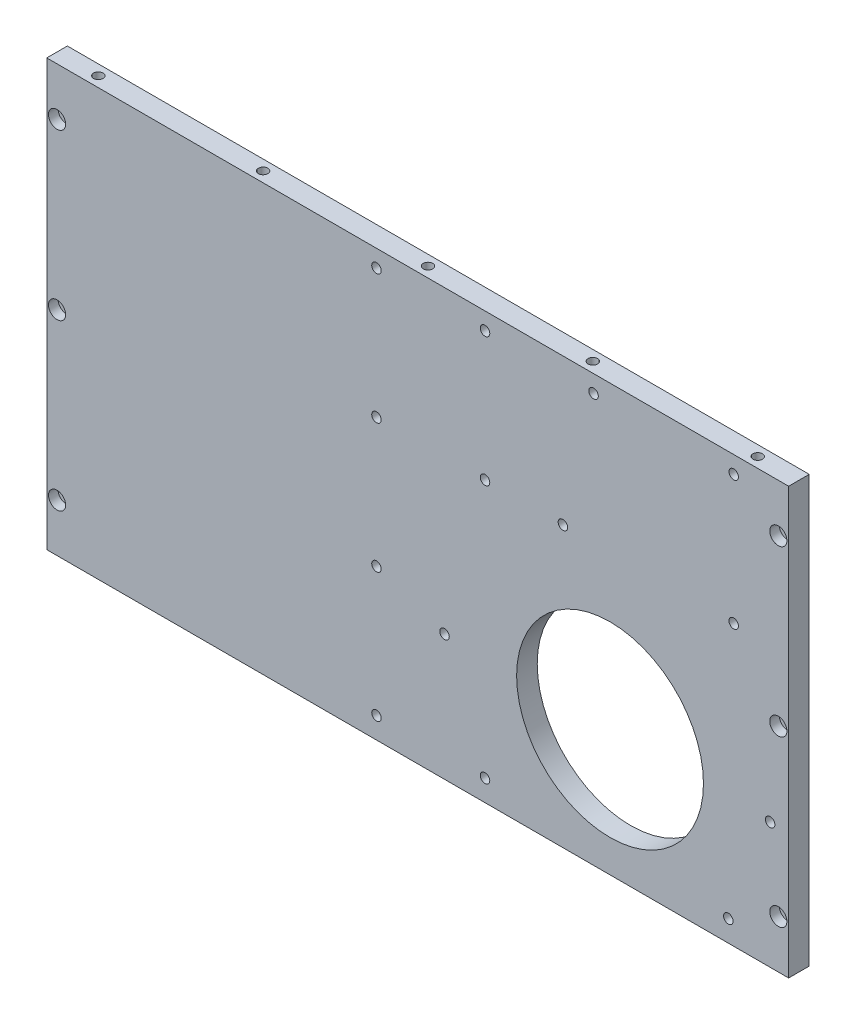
SolidWorks part; units mm, degrees
ref_plane "Front Plane" through (0, 0, 0) normal (0, 0, 1) x (1, 0, 0)
ref_plane "Top Plane" through (0, 0, 0) normal (0, 1, 0) x (1, 0, 0)
ref_plane "Right Plane" through (0, 0, 0) normal (1, 0, 0) x (0, 0, -1)
sketch "Sketch1" plane through (0, 0, 0) normal (0, 0, 1) x (1, 0, 0)
  line L1 (-171.45, 98.425) -> (171.45, 98.425)
  line L2 (-171.45, 98.425) -> (-171.45, -98.425)
  line L3 (-171.45, -98.425) -> (171.45, -98.425)
  line L4 (171.45, 98.425) -> (171.45, -98.425)
  line L5 (-171.45, 98.425) -> (171.45, -98.425) construction
  line L6 (-171.45, -98.425) -> (171.45, 98.425) construction
  point P0 (0, 0)
  dimension "D1" = 196.85
  dimension "D2" = 342.9
extrude "Boss-Extrude1" add sketch "Sketch1" along normal blind 9.525
sketch "Sketch2" plane through (0, 0, 0) normal (0, 0, 1) x (1, 0, 0)
  line L0 (0, 110.9277) -> (0, -114.8199) construction
  line L1 (-166.6875, 98.425) -> (-166.6875, -98.425) construction
  line L2 (171.45, 98.425) -> (-171.45, 98.425) construction
  line L3 (-171.45, -98.425) -> (171.45, -98.425) construction
  line L4 (-171.45, 98.425) -> (-171.45, -98.425) construction
  circle A0 centre (-166.6875, 0) radius 1.27 construction
  circle A1 centre (-166.6875, 38.1) radius 1.27 construction
  circle A2 centre (-166.6875, 76.2) radius 1.27 construction
  circle A3 centre (-166.6875, -38.1) radius 1.27 construction
  circle A4 centre (-166.6875, -76.2) radius 1.27 construction
  circle A5 centre (166.6875, -76.2) radius 1.27 construction
  circle A6 centre (166.6875, -38.1) radius 1.27 construction
  circle A7 centre (166.6875, 76.2) radius 1.27 construction
  circle A8 centre (166.6875, 38.1) radius 1.27 construction
  circle A9 centre (166.6875, 0) radius 1.27 construction
  dimension "D2" = 2.54
  dimension "D1" = 4.7625
  dimension "D3" = 3
  dimension "D4" = 3
hole_wizard "CBORE for #8 Binding Head Machine Screw1" positions "Sketch3" profile "Sketch4" counterbore size "#8" standard "ANSI Inch"
sketch "Sketch3" plane through (0, 0, 9.525) normal (0, 0, 1) x (1, 0, 0)
  line L0 (-166.6875, 98.425) -> (-166.6875, -98.425) construction
  point P0 (-166.6875, 76.2)
  point P6 (-166.6875, 0)
  point P13 (-166.6875, -76.2)
  point P16 (166.6875, 76.2)
  point P22 (166.6875, 0)
  point P28 (166.6875, -76.2)
sketch "Sketch4" plane through (-166.6875, 76.2, 9.525) normal (1, 0, 0) x (0, -1, 0)
  line L0 (0, 0) -> (0, 9.525)
  line L1 (0, 9.525) -> (2.1526, 9.525)
  line L3 (2.1526, 9.525) -> (2.1527, 4.4196)
  line L4 (2.1527, 4.4196) -> (3.9688, 4.4196)
  line L5 (3.9688, 4.4196) -> (3.9688, 0)
  line L7 (3.9688, 0) -> (0, 0)
  line L11 (0, -6.35) -> (0, 107.95) construction
  dimension "Thru Hole Dia." = 4.3053
  dimension "Thru Hole Depth" = 9.525
  dimension "C'Bore Dia." = 7.9375
  dimension "C'Bore Depth" = 4.4196
sketch "Sketch5" plane through (0, 98.425, 0) normal (0, 1, 0) x (1, 0, 0)
  line L0 (-171.45, -4.7625) -> (171.45, -4.7625) construction
  line L1 (-171.45, -9.525) -> (-171.45, 0) construction
  line L2 (171.45, -9.525) -> (171.45, 0) construction
  line L3 (0, 0) -> (0, -9.525) construction
  line L4 (171.45, -9.525) -> (-171.45, -9.525) construction
  circle A0 centre (0, -4.7625) radius 2.1971
  circle A1 centre (76.2, -4.7625) radius 2.1971
  circle A2 centre (152.4, -4.7625) radius 2.1971
  circle A4 centre (-76.2, -4.7625) radius 2.1971
  circle A5 centre (-152.4, -4.7625) radius 2.1971
  dimension "D1" = 4.3942
  dimension "D2" = 3
  dimension "D3" = 3
extrude "Cut-Extrude1" cut sketch "Sketch5" against normal blind 15.24
sketch "Sketch6" plane through (0, -98.425, 0) normal (0, -1, 0) x (1, 0, 0)
  line L0 (171.45, 4.7625) -> (-171.45, 4.7625) construction
  line L1 (171.45, 9.525) -> (171.45, 0) construction
  line L2 (-171.45, 9.525) -> (-171.45, 0) construction
  line L3 (0, 0) -> (0, 9.525) construction
  line L4 (-171.45, 9.525) -> (171.45, 9.525) construction
  circle A0 centre (0, 4.7625) radius 2.1971
  circle A1 centre (76.2, 4.7625) radius 2.1971
  circle A2 centre (152.4, 4.7625) radius 2.1971
  circle A4 centre (-76.2, 4.7625) radius 2.1971
  circle A5 centre (-152.4, 4.7625) radius 2.1971
  dimension "D1" = 4.3942
  dimension "D2" = 3
  dimension "D3" = 3
extrude "Cut-Extrude2" cut sketch "Sketch6" against normal blind 15.24
sketch "Sketch7" plane through (0, 0, 9.525) normal (0, 0, 1) x (1, 0, 0)
  circle A0 centre (88.9, -40.2844) radius 43.18
  dimension "D1" = 86.36
extrude "Cut-Extrude3" cut sketch "Sketch7" against normal through all
sketch "Sketch8" plane through (0, 0, 9.525) normal (0, 0, 1) x (1, 0, 0)
  circle A0 centre (-19.05, 90.4875) radius 2.1971
  circle A1 centre (31.115, 90.4875) radius 2.1971
  circle A2 centre (81.28, 90.4875) radius 2.1971
  circle A3 centre (146.05, 90.4875) radius 2.1971
  circle A4 centre (67.1212, 30.7975) radius 2.1971
  circle A5 centre (31.115, 30.7975) radius 2.1971
  circle A6 centre (-19.05, 30.7975) radius 2.1971
  circle A7 centre (-19.05, -28.8925) radius 2.1971
  circle A8 centre (12.3898, -40.2844) radius 2.1971
  circle A9 centre (-19.05, -88.5825) radius 2.1971
  circle A10 centre (31.115, -88.5825) radius 2.1971
  circle A11 centre (146.05, 30.7975) radius 2.1971
  circle A12 centre (162.9011, -40.2844) radius 2.1971
  circle A13 centre (143.5666, -88.5825) radius 2.1971
extrude "Cut-Extrude4" cut sketch "Sketch8" against normal through all
